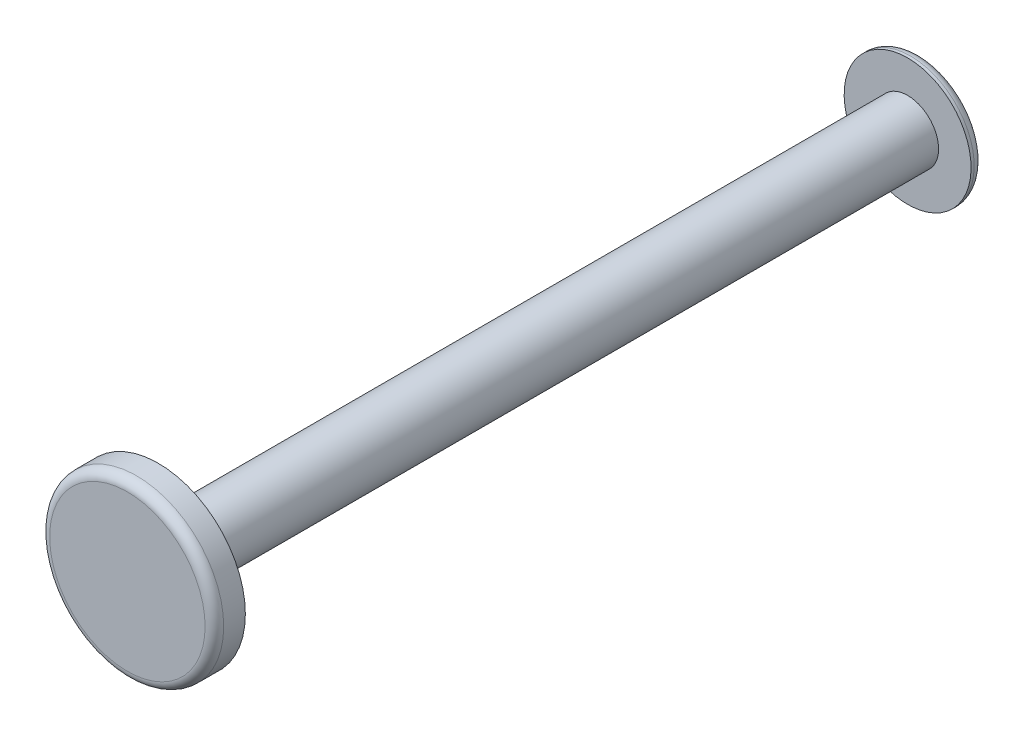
SolidWorks part; units mm, degrees
ref_plane "Plane1" through (0, 0, 0) normal (0, 0, 1) x (1, 0, 0)
ref_plane "Plane2" through (0, 0, 0) normal (0, 1, 0) x (1, 0, 0)
ref_plane "Plane3" through (0, 0, 0) normal (1, 0, 0) x (0, 0, -1)
sketch "Sketch1" plane through (0, 0, 0) normal (0, 0, 1) x (1, 0, 0)
  circle A0 centre (0, 17.5) radius 1 construction
  circle A1 centre (0, 17.5) radius 1
extrude "Base-Extrude" add sketch "Sketch1" against normal up to surface (24.2 mm away)
sketch "Sketch2" plane through (0, 0, 0) normal (0, 0, 1) x (1, 0, 0)
  circle A0 centre (0, 17.5) radius 2.81
  circle A1 centre (0, 17.5) radius 1 construction
  dimension "D1" = 5.62
extrude "Boss-Extrude1" add sketch "Sketch2" along normal blind 1
fillet "Fillet1" radius 0.3
sketch "Sketch3" plane through (0, 0, -24.2) normal (0, 0, -1) x (-1, 0, 0)
  circle A0 centre (0, 17.5) radius 2.05
  dimension "D1" = 4.1
extrude "Boss-Extrude2" add sketch "Sketch3" along normal blind 0.4
sketch "Sketch4" plane through (0, 0, -24.6) normal (0, 0, -1) x (-1, 0, 0)
  line L0 (-0.9184, 17.8957) -> (0.9184, 17.1043) construction
  line L1 (0.9184, 17.1043) -> (-0.9184, 17.8957)
  arc A0 (-0.9184, 17.8957) -> (0.9184, 17.1043) centre (0, 17.5) ccw
  dimension "D1" = 2
revolve "Cut-Revolve1" cut sketch "Sketch4" angle 360 about L0
fillet "Fillet2" radius 0.3
